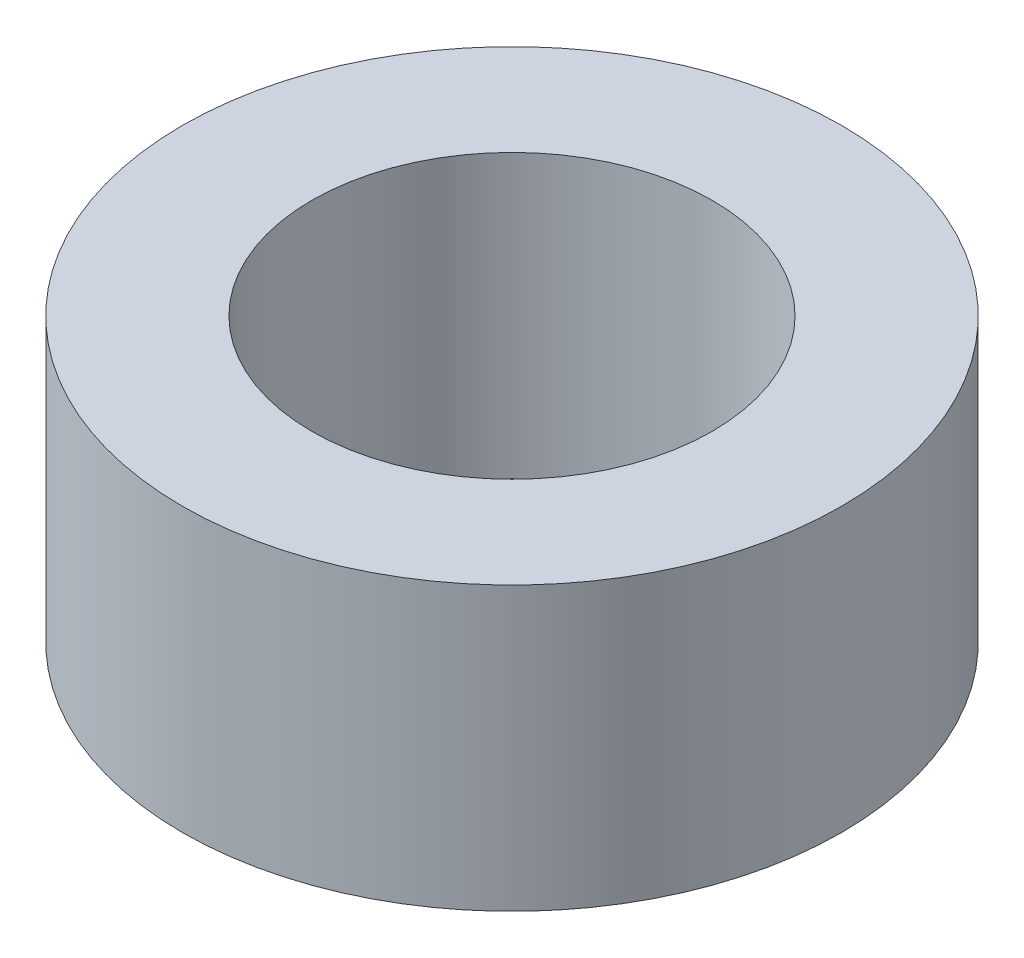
SolidWorks part; units mm, degrees
ref_plane "Front Plane" through (0, 0, 0) normal (0, 0, 1) x (1, 0, 0)
ref_plane "Top Plane" through (0, 0, 0) normal (0, 1, 0) x (1, 0, 0)
ref_plane "Right Plane" through (0, 0, 0) normal (1, 0, 0) x (0, 0, -1)
sketch "Sketch1" plane through (0, 0, 0) normal (0, 1, 0) x (1, 0, 0)
  circle A0 centre (0, 0) radius 2.125
  circle A1 centre (0, 0) radius 3.5
  dimension "D1" = 4.25
  dimension "D2" = 7
extrude "Boss-Extrude1" add sketch "Sketch1" along normal blind 3
